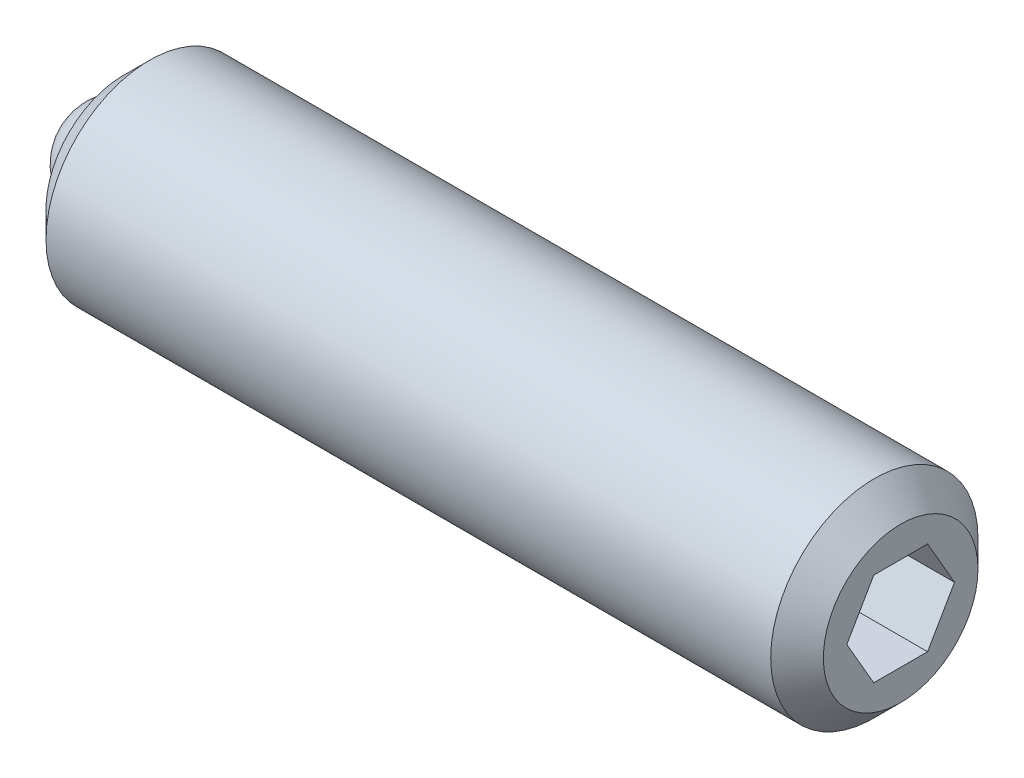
SolidWorks part; units mm, degrees
ref_plane "Front Plane" through (0, 0, 0) normal (0, 0, 1) x (1, 0, 0)
ref_plane "Top Plane" through (0, 0, 0) normal (0, 1, 0) x (1, 0, 0)
ref_plane "Right Plane" through (0, 0, 0) normal (1, 0, 0) x (0, 0, -1)
sketch "Sketch2" plane through (0, 0, 0) normal (1, 0, 0) x (0, 0, -1)
  circle A0 centre (0, 0) radius 1
  dimension "D1" = 2
extrude "Boss-Extrude1" add sketch "Sketch2" along normal blind 7.5
sketch "Sketch3" plane through (0, 0, 0) normal (-1, 0, 0) x (0, 0, 1)
  circle A0 centre (0, 0) radius 0.5
  dimension "D1" = 1
chamfer "Chamfer1" distance 0.254 angle 45 1 edges at (0, 0, -1)
chamfer "Chamfer2" distance 0.254 angle 45 1 edges at (7.5, 0, -1)
sketch "Sketch4" plane through (7.5, 0, 0) normal (1, 0, 0) x (0, 0, -1)
  line L1 (0.5196, 0) -> (0.2598, 0.45)
  line L2 (0.2598, 0.45) -> (-0.2598, 0.45)
  line L3 (-0.2598, 0.45) -> (-0.5196, 0)
  line L4 (-0.5196, 0) -> (-0.2598, -0.45)
  line L5 (-0.2598, -0.45) -> (0.2598, -0.45)
  line L6 (0.2598, -0.45) -> (0.5196, 0)
  circle A0 centre (0, 0) radius 0.45 construction
  dimension "D1" = 0.9
extrude "Cut-Extrude2" cut sketch "Sketch4" against normal blind 2
extrude "Cut-Extrude3" cut sketch "Sketch3" against normal blind 0.5
sketch "Sketch5" plane through (0, 0, 0) normal (-1, 0, 0) x (0, 0, 1)
  line L0 (0, 0) -> (0, -0.5)
  line L1 (0, 0) -> (0, 0.5)
  arc A0 (0, 0.5) -> (0, -0.5) centre (0, 0) ccw
  dimension "D1" = 0.5
revolve "Revolve1" add sketch "Sketch5" angle 360 about L1
